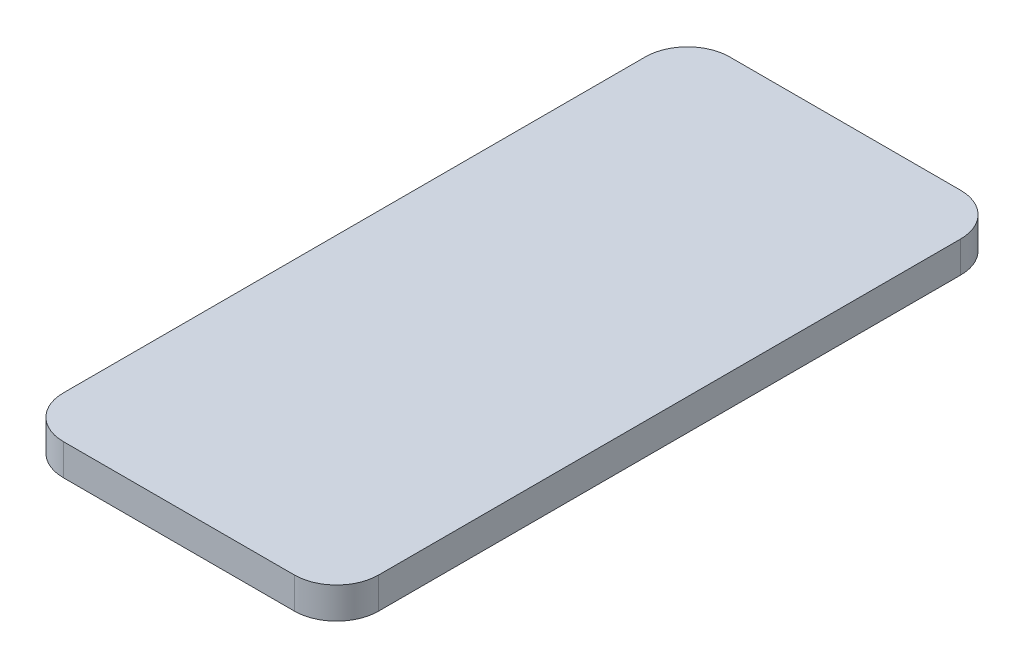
SolidWorks part; units mm, degrees
ref_plane "前视基准面" through (0, 0, 0) normal (0, 0, 1) x (1, 0, 0)
ref_plane "上视基准面" through (0, 0, 0) normal (0, 1, 0) x (1, 0, 0)
ref_plane "右视基准面" through (0, 0, 0) normal (1, 0, 0) x (0, 0, -1)
other "Configuration Table"
sketch "草图1" plane through (0, 0, 0) normal (0, 1, 0) x (1, 0, 0)
  line L0 (-27.365, 0) -> (27.365, 0)
  line L1 (37.365, -10) -> (37.365, -147.9)
  line L2 (27.365, -157.9) -> (-27.365, -157.9)
  line L3 (-37.365, -147.9) -> (-37.365, -10)
  arc A0 (27.365, 0) -> (37.365, -10) centre (27.365, -10) cw
  arc A1 (37.365, -147.9) -> (27.365, -157.9) centre (27.365, -147.9) cw
  arc A2 (-27.365, -157.9) -> (-37.365, -147.9) centre (-27.365, -147.9) cw
  arc A3 (-37.365, -10) -> (-27.365, 0) centre (-27.365, -10) cw
extrude "01_PHONE_BODY" add sketch "草图1" against normal blind 7.42
